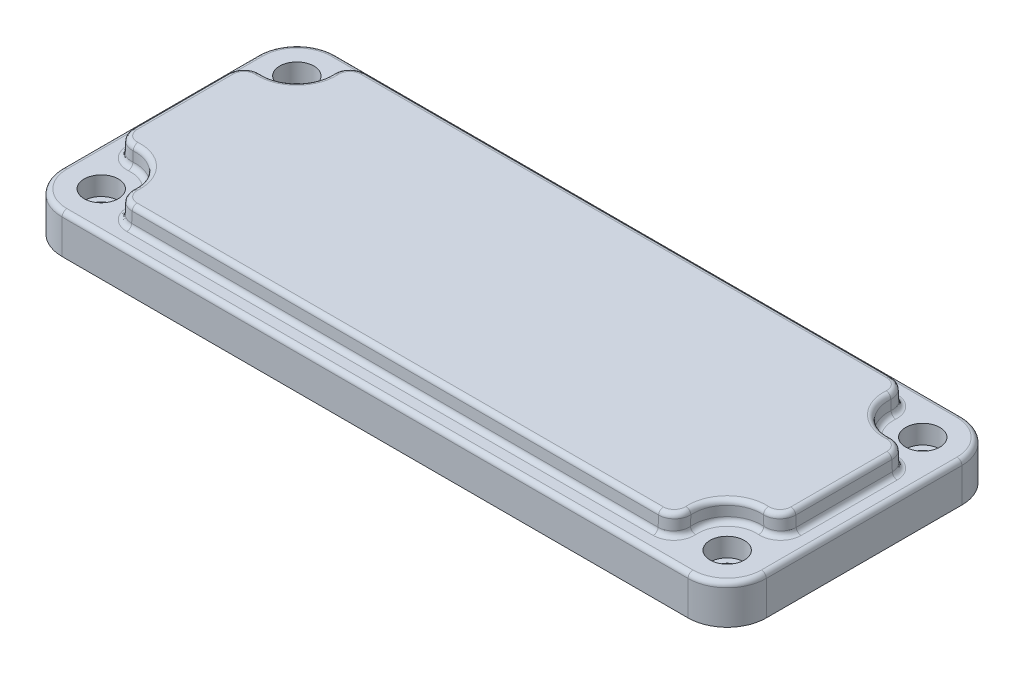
SolidWorks part; units mm, degrees
ref_plane "Front" through (0, 0, 0) normal (0, 0, 1) x (1, 0, 0)
ref_plane "Top" through (0, 0, 0) normal (0, 1, 0) x (1, 0, 0)
ref_plane "Right" through (0, 0, 0) normal (1, 0, 0) x (0, 0, -1)
sketch "Sketch1" plane through (0, 0, 0) normal (0, 1, 0) x (1, 0, 0)
  line L0 (-50.8, 22.225) -> (50.8, 22.225)
  line L1 (-57.15, 15.875) -> (-57.15, -15.875)
  line L2 (50.8, -22.225) -> (-50.8, -22.225)
  line L3 (57.15, -15.875) -> (57.15, 15.875)
  line L4 (-50.8, -15.875) -> (50.8, 15.875) construction
  arc A0 (-57.15, -15.875) -> (-50.8, -22.225) centre (-50.8, -15.875) ccw
  arc A1 (57.15, -15.875) -> (50.8, -22.225) centre (50.8, -15.875) cw
  arc A2 (50.8, 22.225) -> (57.15, 15.875) centre (50.8, 15.875) cw
  arc A3 (-50.8, 22.225) -> (-57.15, 15.875) centre (-50.8, 15.875) ccw
  dimension "D1" = 114.3
  dimension "D2" = 44.45
  dimension "D4" = 6.35
extrude "Base-Extrude" add sketch "Sketch1" along normal blind 6.35
sketch "Sketch2" plane through (0, 6.35, 0) normal (0, 1, 0) x (-1, 0, 0)
  line L4 (50.8, 19.05) -> (-50.8, 19.05)
  line L5 (-53.975, 15.875) -> (-53.975, -15.875)
  line L6 (-50.8, -19.05) -> (50.8, -19.05)
  line L7 (53.975, -15.875) -> (53.975, 15.875)
  line L8 (50.8, 19.05) -> (-50.8, 19.05)
  line L9 (-53.975, 15.875) -> (-53.975, -15.875)
  line L10 (-50.8, -19.05) -> (50.8, -19.05)
  line L11 (53.975, -15.875) -> (53.975, 15.875)
  arc A4 (53.975, 15.875) -> (50.8, 19.05) centre (50.8, 15.875) ccw
  arc A5 (53.975, 15.875) -> (50.8, 19.05) centre (50.8, 15.875) ccw
  arc A6 (-50.8, 19.05) -> (-53.975, 15.875) centre (-50.8, 15.875) ccw
  arc A7 (-50.8, 19.05) -> (-53.975, 15.875) centre (-50.8, 15.875) ccw
  arc A8 (-53.975, -15.875) -> (-50.8, -19.05) centre (-50.8, -15.875) ccw
  arc A9 (-53.975, -15.875) -> (-50.8, -19.05) centre (-50.8, -15.875) ccw
  arc A10 (50.8, -19.05) -> (53.975, -15.875) centre (50.8, -15.875) ccw
  arc A11 (50.8, -19.05) -> (53.975, -15.875) centre (50.8, -15.875) ccw
  dimension "D1" = 3.175
extrude "Boss-Extrude1" add sketch "Sketch2" along normal blind 3.175 draft 3
sketch "Sketch3" plane through (0, 9.525, 0) normal (0, 1, 0) x (-1, 0, 0)
  circle A0 centre (-50.8, 15.875) radius 5.5562
  dimension "D1" = 11.1125
extrude "Cut-Extrude1" cut sketch "Sketch3" against normal up to surface (3.175 mm away)
mirror "Mirror1" about plane through (0, 0, 0) normal (0, 0, 1) of "Cut-Extrude1"
mirror "Mirror2" about plane through (0, 0, 0) normal (1, 0, 0) of "Mirror1", "Cut-Extrude1"
fillet "Fillet1" radius 2.54 8 edges at (53.8923, 7.9279, 11.2588) (46.1838, 7.9279, 18.9673) (53.8923, 7.9279, -11.2588) (46.1838, 7.9279, -18.9673) (-53.8923, 7.9279, -11.2588) (-46.1838, 7.9279, -18.9673) (-46.1838, 7.9279, 18.9673) (-53.8923, 7.9279, 11.2588)
fillet "Fillet2" radius 0.7937 52 edges at (55.2901, 6.35, 20.3651) (53.2526, 9.525, -9.3774) (52.7392, 9.525, 9.8623) (44.3024, 9.525, 18.3276) (51.1763, 7.9369, 10.3315) (45.2565, 7.9369, 16.2513) (53.975, 6.35, 0) (53.8918, 7.9369, -7.7978) (53.8918, 7.9369, 7.7978) (45.2565, 7.9369, -16.2513) (51.1763, 7.9369, -10.3315) (0, 6.35, -19.05) (-42.7228, 7.9369, -18.9668) (42.7228, 7.9369, -18.9668) (-51.1763, 7.9369, -10.3315) (-45.2565, 7.9369, -16.2513) (-53.975, 6.35, 0) (-53.8918, 7.9369, 7.7978) (-53.8918, 7.9369, -7.7978) (-45.2565, 7.9369, 16.2513) (-51.1763, 7.9369, 10.3315) (44.6673, 6.35, 18.15) (53.24, 6.35, 9.5899) (53.0989, 6.35, -9.7219) (44.5508, 6.35, -18.2787) (-44.6372, 6.35, -18.185) (-53.2237, 6.35, -9.6062) (-53.0761, 6.35, 9.7414) (-44.513, 6.35, 18.3169) (57.15, 6.35, 0) (55.2901, 6.35, -20.3651) (0, 6.35, -22.225) (-55.2901, 6.35, -20.3651) (-57.15, 6.35, 0) (-55.2901, 6.35, 20.3651) (0, 6.35, 22.225) (0, 6.35, 19.05) (0, 9.525, 18.8836) (-42.7228, 7.9369, 18.9668) (42.7228, 7.9369, 18.9668) (-53.8086, 9.525, 0) (-46.8711, 9.525, 11.9461) (46.8711, 9.525, 11.9461) (53.8086, 9.525, 0) (46.8711, 9.525, -11.9461) (0, 9.525, -18.8836) (-46.8711, 9.525, -11.9461) (-44.7873, 9.525, 17.8142) (-53.2526, 9.525, 9.3774) (-52.7392, 9.525, -9.8623) (-44.3024, 9.525, -18.3276) (44.7873, 9.525, -17.8142)
sketch "Sketch5" plane through (0, 0, 0) normal (0, -1, 0) x (1, 0, 0)
  line L0 (-44.45, 15.875) -> (44.45, 15.875)
  line L1 (-44.45, 15.875) -> (-44.45, -15.875)
  line L2 (44.45, -15.875) -> (-44.45, -15.875)
  line L3 (44.45, -15.875) -> (44.45, 15.875)
  line L4 (50.8, 22.225) -> (-50.8, 22.225) construction
  line L5 (57.15, 15.875) -> (57.15, -15.875) construction
  line L6 (-57.15, -15.875) -> (-57.15, 15.875) construction
  line L7 (-50.8, -22.225) -> (50.8, -22.225) construction
  dimension "D1" = 6.35
  dimension "D2" = 12.7
  dimension "D3" = 12.7
  dimension "D4" = 6.35
extrude "Cut-Extrude3" cut sketch "Sketch5" against normal blind 6.35 draft 3
fillet "Fillet3" radius 6.35 4 edges at (-44.2836, 3.175, -15.7086) (-44.2836, 3.175, 15.7086) (44.2836, 3.175, 15.7086) (44.2836, 3.175, -15.7086)
fillet "Fillet4" radius 3.175 8 edges at (-44.1172, 6.35, 0) (0, 6.35, 15.5422) (0, 6.35, -15.5422) (44.1172, 6.35, 0) (-42.2609, 6.35, -13.6859) (42.2609, 6.35, 13.6859) (42.2609, 6.35, -13.6859) (-42.2609, 6.35, 13.6859)
hole_wizard "CBORE for #5 Fillister Head Machine Screw1" positions "Sketch6" profile "Sketch7" counterbore size "#5" standard "Ansi Inch"
sketch "Sketch6" plane through (0, 6.35, 0) normal (0, 1, 0) x (-1, 0, 0)
  point P0 (-50.8, 15.875)
  point P1 (-50.8, -15.875)
  point P2 (50.8, -15.875)
  point P3 (50.8, 15.875)
sketch "Sketch7" plane through (50.8, 6.35, 15.875) normal (1, 0, 0) x (0, 0, 1)
  line L0 (0, 0) -> (0, 6.35)
  line L1 (0, 6.35) -> (1.7272, 6.35)
  line L2 (1.7272, 6.35) -> (1.7272, 3.048)
  line L3 (1.7272, 3.048) -> (2.7788, 3.048)
  line L4 (2.7788, 3.048) -> (2.7788, 0)
  line L5 (2.7788, 0) -> (0, 0)
  line L6 (0, -6.35) -> (0, 107.95) construction
  dimension "Thru Hole Dia." = 3.4544
  dimension "Thru Hole Depth" = 6.35
  dimension "C'Bore Dia." = 5.5575
  dimension "C'Bore Depth" = 3.048
